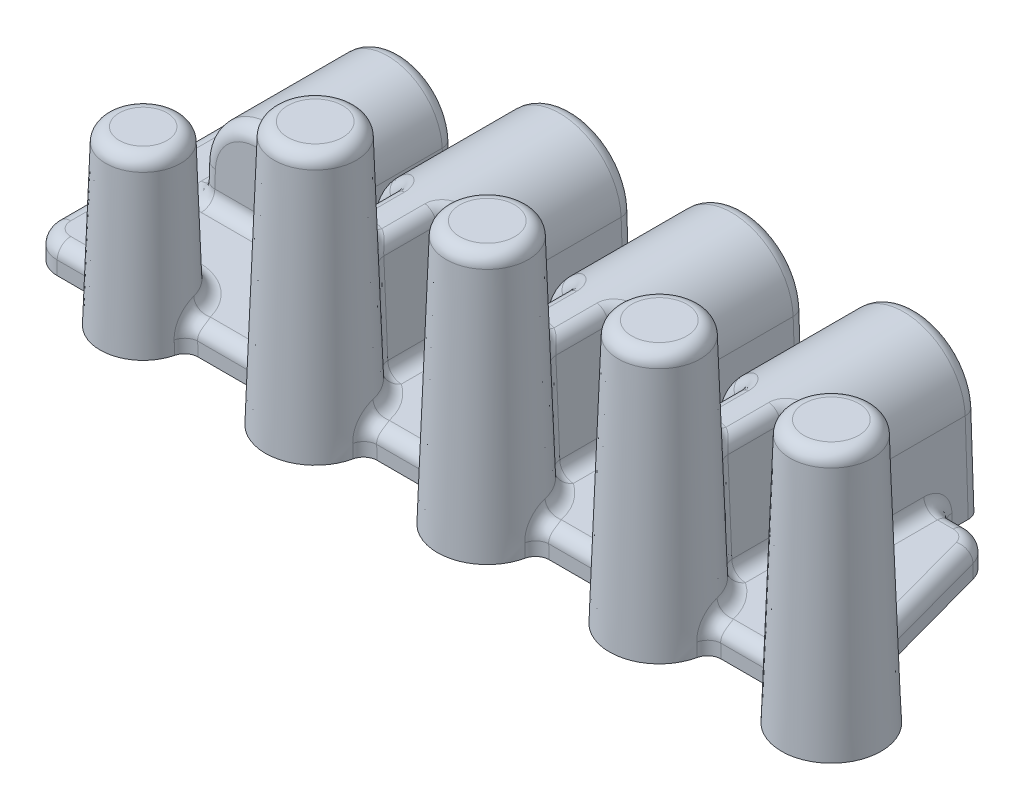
SolidWorks part; units mm, degrees
other "<2B_&>-<Fillet1>"
other "<1B>-<Fillet1>"
other "<1A>-<Fillet1>"
other "<2A>-<Fillet1>"
ref_plane "Front Plane" through (0, 0, 0) normal (0, 0, 1) x (1, 0, 0)
ref_plane "Top Plane" through (0, 0, 0) normal (0, 1, 0) x (1, 0, 0)
ref_plane "Right Plane" through (0, 0, 0) normal (1, 0, 0) x (0, 0, -1)
inserted part "2B_&"
inserted part "1B"
move or copy body "Body-Move/Copy2"
inserted part "2A"
move or copy body "Body-Move/Copy6"
inserted part "1A"
move or copy body "Body-Move/Copy4"
pattern_linear "LPattern1" count 4 spacing 38 along (-1, 0, 0)
pattern_linear "LPattern2" count 3 spacing 38 along (-1, 0, 0)
sketch "Sketch1" plane through (0, 0, -25) normal (0, 0, 1) x (1, 0, 0)
  line L0 (-38, 32.5782) -> (-38, 0) construction
  line L1 (-42.75, 31.7203) -> (-42.75, 0)
  line L2 (-33.25, 31.7203) -> (-33.25, 0)
  line L3 (-23.75, 0) -> (-24.43, 19.4739)
  line L4 (-51.57, 19.4739) -> (-52.25, 0)
  line L5 (-52.25, 0) -> (-23.75, 0)
  line L8 (-42.75, 0) -> (-33.25, 0)
  arc A1 (-24.43, 19.4739) -> (-51.57, 19.4739) centre (-38, 19) ccw
  arc A2 (-33.25, 31.7203) -> (-42.75, 31.7203) centre (-38, 19) ccw
  dimension "D2" = 9.5
  dimension "D1" = 0
extrude "Boss-Extrude1" add sketch "Sketch1" along normal up to next separate body
pattern_linear "LPattern3" count 3 spacing 38 along (-1, 0, 0)
sketch "Sketch2" plane through (0, 0, 0) normal (0, 1, 0) x (1, 0, 0)
  line L0 (-152, 54) -> (-152, 25) construction
  line L1 (-171, 47.5) -> (-17.5785, 47.5)
  line L2 (-177, 41.5) -> (-177, 6)
  line L3 (-171, 0) -> (0, 0)
  line L4 (-11.7914, 43.0839) -> (0, 0)
  line L5 (-38, 54) -> (-38, 25) construction
  line L6 (-142.9494, 57) -> (-161.0506, 57) construction
  arc A0 (-177, 6) -> (-171, 0) centre (-171, 6) ccw
  arc A1 (-17.5785, 47.5) -> (-11.7914, 43.0839) centre (-17.5785, 41.5) cw
  arc A2 (-171, 47.5) -> (-177, 41.5) centre (-171, 41.5) ccw
  point P16 (-13, 47.5)
  dimension "D4" = 6
  dimension "D1" = 25
  dimension "D2" = 25
  dimension "D3" = 9.5
extrude "Boss-Extrude2" add sketch "Sketch2" along normal blind 6
fillet "Fillet1" radius 3 98 edges at (-95, 6, 0) (-123.1567, 6, -5.7087) (-103.1048, 3, 0) (-124.8952, 3, 0) (-95, 6, -47.5) (-66.6048, 6, -25) (-90.0405, 6, -36.25) (-61.9595, 6, -36.25) (-61.8548, 3, -47.5) (-90.1452, 3, -47.5) (-62.1948, 12.7369, -25) (-64.9819, 26.9353, -25) (-89.8052, 12.7369, -25) (-133.875, 6, -47.5) (-104.6048, 6, -25) (-128.0405, 6, -36.25) (-99.9595, 6, -36.25) (-99.8548, 3, -47.5) (-128.1452, 3, -47.5) (-100.1948, 12.7369, -25) (-102.9819, 26.9353, -25) (-127.8052, 12.7369, -25) (-8.5782, 6, -6.5459) (-28.8433, 6, -5.7087) (-47.3952, 6, -25) (-49.0181, 26.9353, -25) (-42.75, 6, -17.3444) (-33.25, 6, -17.3444) (-38.8727, 32.5502, -9.8246) (-42.75, 31.7203, -16.8386) (-42.75, 18.8601, -25) (-33.25, 31.7203, -16.8386) (-33.25, 18.8601, -25) (-2.8761, 3, -10.5088) (-85.3952, 6, -25) (-87.0181, 26.9353, -25) (-71.25, 18.8601, -25) (-10.8952, 3, 0) (-66.8433, 6, -5.7087) (-80.75, 6, -17.3444) (-71.25, 6, -17.3444) (-76.8727, 32.5502, -9.8246) (-80.75, 31.7203, -16.8386) (-80.75, 18.8601, -25) (-71.25, 31.7203, -16.8386) (-123.3952, 6, -25) (-125.0181, 26.9353, -25) (-109.25, 18.8601, -25) (-104.8433, 6, -5.7087) (-118.75, 6, -17.3444) (-109.25, 6, -17.3444) (-114.8727, 32.5502, -9.8246) (-118.75, 31.7203, -16.8386) (-118.75, 18.8601, -25) (-109.25, 31.7203, -16.8386) (-7.3199, 6, -26.7458) (-13.9387, 6, -46.2699) (-20.769, 6, -47.5) (-175.2426, 6, -45.7426) (-177, 6, -23.75) (-175.2426, 6, -1.7574) (-166.1452, 6, 0) (-57, 6, -47.5) (-28.6048, 6, -25) (-52.0405, 6, -36.25) (-23.9595, 6, -36.25) (-23.8548, 3, -47.5) (-52.1452, 3, -47.5) (-24.1948, 12.7369, -25) (-26.9819, 26.9353, -25) (-51.8052, 12.7369, -25) (-167.6452, 6, -47.5) (-152, 6, -25) (-164.2905, 6, -36.25) (-139.7095, 6, -36.25) (-139.6048, 3, -47.5) (-164.3952, 3, -47.5) (-139.8304, 9.4604, -25) (-152, 24.5561, -25) (-164.1696, 9.4604, -25) (-133.75, 6, 0) (-152, 6, -9.2905) (-142.6048, 3, 0) (-161.3952, 3, 0) (-19, 6, 0) (-47.1567, 6, -5.7087) (-27.1048, 3, 0) (-48.8952, 3, 0) (-57, 6, 0) (-85.1567, 6, -5.7087) (-65.1048, 3, 0) (-86.8952, 3, 0)
